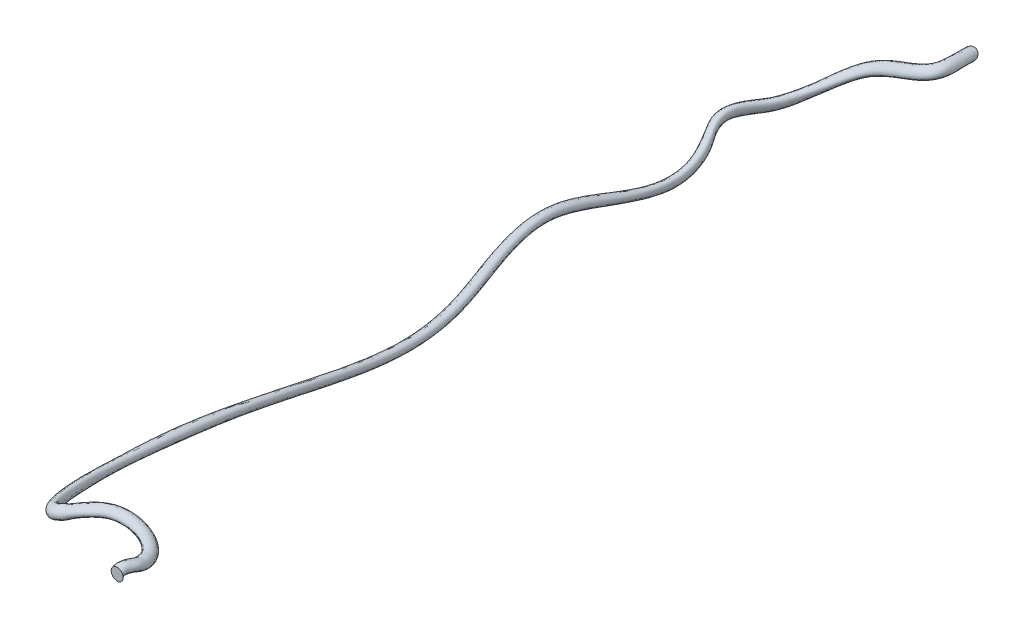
SolidWorks part; units mm, degrees
ref_plane "Plan de face" through (0, 0, 0) normal (0, 0, 1) x (1, 0, 0)
ref_plane "Plan de dessus" through (0, 0, 0) normal (0, 1, 0) x (1, 0, 0)
ref_plane "Plan de droite" through (0, 0, 0) normal (1, 0, 0) x (0, 0, -1)
sketch "Esquisse1" plane through (0, 0, 0) normal (0, 0, 1) x (1, 0, 0)
  point P0 (0, 0.8602)
sketch3d "Esquisse3D2"
  spline S0 degree 3 poles (0, 0.8602, 0) (0.0189, 0.9237, 0.5802) (0.4687, 1.0786, 3.2261) (-4.9827, -0.6496, 1.6884) (-6.6823, -3.079, 5.7536) (-8.0306, -1.7866, 8.7371) (-6.2982, -4.935, 12.86) (-9.3205, -1.2107, 19.0443) (-4.8376, -4.7178, 31.8958) (-7.0409, -1.1298, 39.8454) (-6.9926, -1.2199, 57.4772) (-2.7415, 0.3831, 53.4593) (1.8043, -0.2811, 55.3401) (0.744, 0.3658, 57.6907) (0.8387, 0.0985, 58) knots 0 0 0 0 0.027415 0.087124 0.161672 0.212252 0.212252 0.355945 0.46617 0.765776 0.877919 0.913213 0.981854 1 1 1 1
sketch "Esquisse2" plane through (0, 0, 58) normal (0, 0, -1) x (-1, 0, 0)
  circle A0 centre (-0.8387, 0.0985) radius 0.4012
sweep "Balayage2" add profiles "Esquisse2" path "Esquisse3D2"
